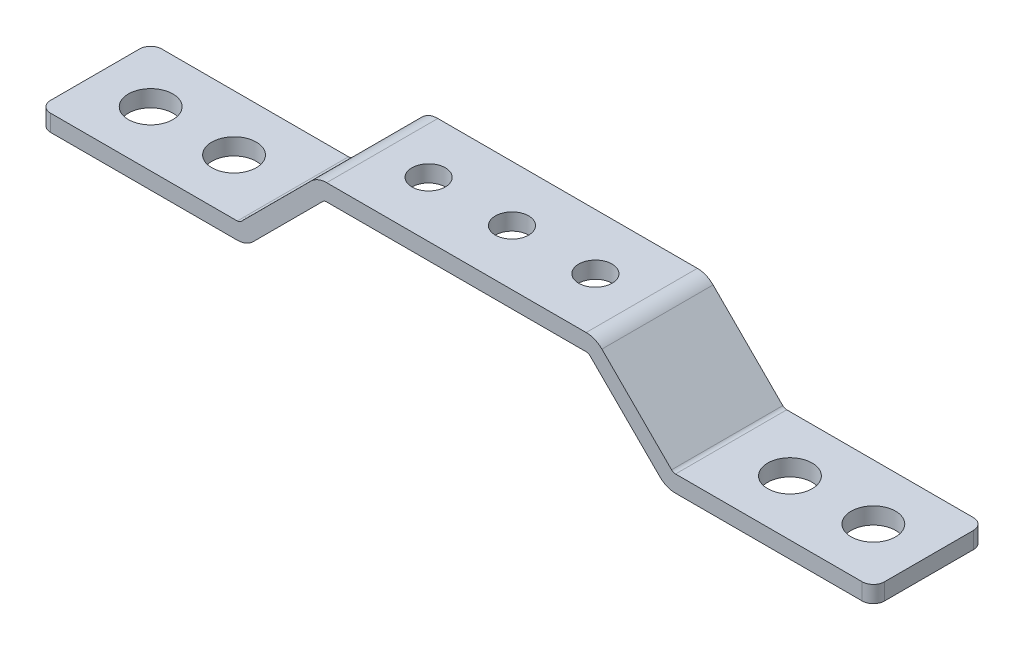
SolidWorks part; units mm, degrees
ref_plane "Front" through (0, 0, 0) normal (0, 0, 1) x (1, 0, 0)
ref_plane "Top" through (0, 0, 0) normal (0, 1, 0) x (1, 0, 0)
ref_plane "Right" through (0, 0, 0) normal (1, 0, 0) x (0, 0, -1)
sketch "Sketch1" plane through (0, 0, 0) normal (0, 0, 1) x (1, 0, 0)
  line L0 (-25, 0) -> (25, 0)
  line L1 (25, 0) -> (39, -14)
  line L2 (0, 0) -> (0, 73.7927) construction
  line L3 (-25, 0) -> (-39, -14)
  line L4 (39, -14) -> (75, -14)
  line L5 (-39, -14) -> (-75, -14)
  point P7 (0, 0)
  dimension "D1" = 50
  dimension "D2" = 14
  dimension "D3" = 135
  dimension "D4" = 150
extrude "Base-Extrude-Thin" add sketch "Sketch1" along normal mid plane 20 thin
sketch "Sketch2" plane through (0, 0, 0) normal (0, 1, 0) x (-1, 0, 0)
  line L0 (0, 0) -> (0, -22.3921) construction
  circle A0 centre (0, 0) radius 3
  circle A1 centre (-15, 0) radius 3
  circle A2 centre (15, 0) radius 3
  dimension "D1" = 6
  dimension "D2" = 15
extrude "Cut-Extrude1" cut sketch "Sketch2" against normal through all
fillet "Fillet1" radius 2 4 edges at (75, -15.5, -10) (-75, -15.5, -10) (75, -15.5, 10) (-75, -15.5, 10)
sketch "Sketch4" plane through (-49.895, -14, 1.6729) normal (0, 1, 0) x (-1, 0, 0)
  line L0 (0.105, -1.6729) -> (-99.895, -1.6729) construction
  line L1 (25.105, 6.3271) -> (25.105, -9.6729) construction
  circle A0 centre (0.105, -1.6729) radius 4
  circle A2 centre (15.105, -1.6729) radius 4
  dimension "D1" = 8
  dimension "D2" = 10
  dimension "D3" = 15
extrude "Cut-Extrude3" cut sketch "Sketch4" against normal through all
mirror "Mirror2" about plane through (0, 0, 0) normal (1, 0, 0) of "Cut-Extrude3"
